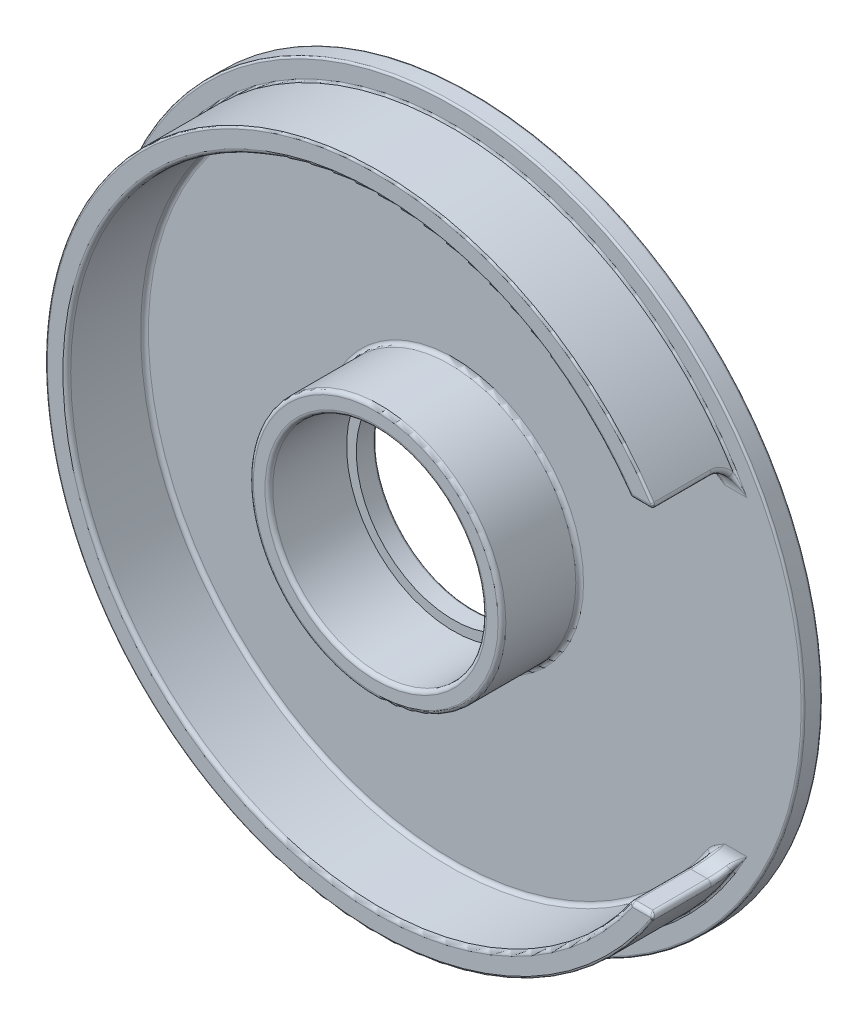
SolidWorks part; units mm, degrees
ref_plane "Plan1" through (0, 0, 0) normal (0, 0, 1) x (1, 0, 0)
ref_plane "Plan2" through (0, 0, 0) normal (0, 1, 0) x (1, 0, 0)
ref_plane "Plan3" through (0, 0, 0) normal (1, 0, 0) x (0, 0, -1)
sketch "Esquisse1" plane through (0, 0, 0) normal (0, 0, 1) x (1, 0, 0)
  circle A0 centre (0, 0) radius 18
  dimension "D1" = 36
extrude "Extrusion1" add sketch "Esquisse1" along normal blind 5
sketch "Esquisse2" plane through (0, 0, 5) normal (0, 0, 1) x (1, 0, 0)
  circle A0 centre (0, 0) radius 17
  dimension "D1" = 34
extrude "Enlèv. mat.-Extru.1" cut sketch "Esquisse2" against normal blind 4 flip side to cut
sketch "Esquisse3" plane through (0, 0, 0) normal (0, 0, -1) x (-1, 0, 0)
  circle A0 centre (0, 0) radius 5
  dimension "D1" = 10
extrude "Enlèv. mat.-Extru.2" cut sketch "Esquisse3" against normal blind 64
fillet "Congé1" radius 0.1
sketch "Esquisse4" plane through (0, 0, 5) normal (0, 0, 1) x (1, 0, 0)
  circle A0 centre (0, 0) radius 5.5
  dimension "D1" = 11
extrude "Enlèv. mat.-Extru.3" cut sketch "Esquisse4" against normal blind 4
sketch "Esquisse5" plane through (0, 0, 5) normal (0, 0, 1) x (1, 0, 0)
  circle A2 centre (0, 0) radius 6.5
  circle A3 centre (0, 0) radius 6.5
  circle A5 centre (0, 0) radius 15.9
  circle A6 centre (0, 0) radius 15.9
  dimension "D1" = 1
  dimension "D2" = 1
extrude "Enlèv. mat.-Extru.4" cut sketch "Esquisse5" against normal blind 4
ref_plane "Plan4" through (30, 0, 0) normal (1, 0, 0) x (0, 0, -1)
sketch "Esquisse7" plane through (30, 0, 0) normal (1, 0, 0) x (0, 0, -1)
  line L0 (-1, 17.9) -> (-1, -17.9) construction
  line L1 (-1, 8) -> (-1, -8)
  line L2 (0, 0) -> (-9.5479, 0) construction
  line L3 (-2, 9) -> (-6.4988, 9)
  line L4 (-2, -9) -> (-6.4988, -9)
  line L5 (-6.4988, 9) -> (-6.4988, -9)
  arc A0 (-2, 9) -> (-1, 8) centre (-2, 8) cw
  arc A1 (-2, -9) -> (-1, -8) centre (-2, -8) ccw
  point P10 (-6.4988, 0)
  point P12 (-1, 9)
  point P15 (-1, -9)
  dimension "D2" = 1
  dimension "D1" = 18
extrude "Enlèv. mat.-Extru.6" cut sketch "Esquisse7" against normal blind 18
fillet "Congé2" radius 0.2
